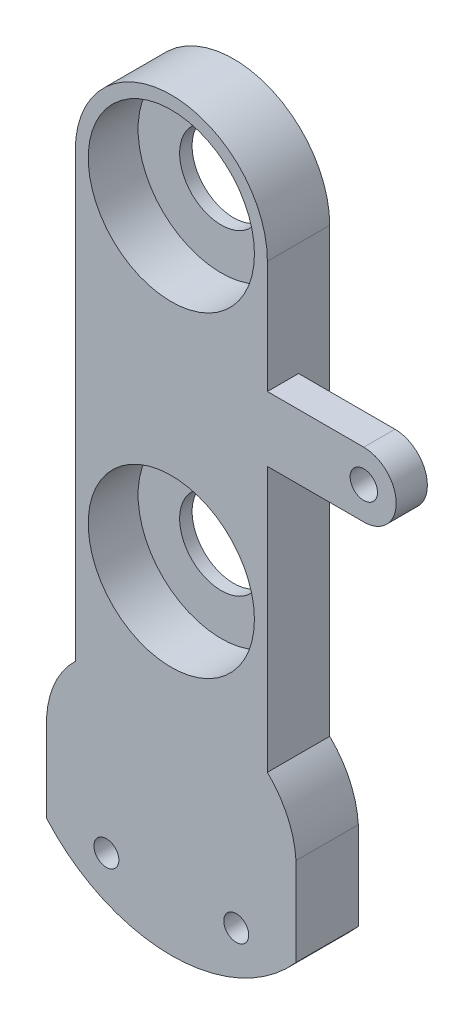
SolidWorks part; units mm, degrees
ref_plane "Front Plane" through (0, 0, 0) normal (0, 0, 1) x (1, 0, 0)
ref_plane "Top Plane" through (0, 0, 0) normal (0, 1, 0) x (1, 0, 0)
ref_plane "Right Plane" through (0, 0, 0) normal (1, 0, 0) x (0, 0, -1)
sketch "Sketch2" plane through (0, 0, 0) normal (0, 0, 1) x (1, 0, 0)
  line L2 (0, 0) -> (0, 21.2346)
  line L4 (60.0123, 0) -> (60.0123, 21.2346)
  line L9 (6.8855, 142.6991) -> (6.8855, 113.6827)
  line L10 (30.0061, 66.4505) -> (30.0061, -13.5495) construction
  line L11 (0, 10.6173) -> (60.0123, 10.6173) construction
  line L12 (14.3811, 0) -> (45.6311, 0) construction
  line L13 (53.1268, 115.5577) -> (53.1268, 142.6991)
  line L14 (30.0061, 165.8197) -> (30.0061, 142.6505) construction
  line L15 (30.0061, 66.4505) -> (30.0061, -13.5495) construction
  line L16 (6.8855, 113.6827) -> (6.8855, 36.191)
  line L18 (53.1268, 36.191) -> (53.1268, 99.9564)
  line L20 (76.3256, 99.9564) -> (53.1268, 99.9564)
  line L21 (76.3256, 115.5508) -> (53.1268, 115.5577)
  arc A0 (0, 0) -> (60.0123, 0) centre (30.0061, 26.4505) ccw
  circle A2 centre (30.0061, 142.6505) radius 20
  arc A3 (6.8855, 142.6991) -> (53.1268, 142.6991) centre (30.0061, 142.6991) cw
  circle A7 centre (14.3811, 0) radius 3
  circle A8 centre (45.6311, 0) radius 3
  circle A10 centre (30.0061, 66.4505) radius 20
  arc A11 (0, 21.2346) -> (6.8855, 36.191) centre (22.6023, 19.8923) cw
  arc A12 (60.0123, 21.2346) -> (53.1268, 36.191) centre (37.41, 19.8923) ccw
  arc A13 (76.3256, 99.9564) -> (76.3256, 115.5508) centre (76.3256, 107.7536) ccw
  dimension "D2" = 31.25
  dimension "D4" = 40
  dimension "D3" = 40
  dimension "D5" = 40
  dimension "D8" = 22.6421
  dimension "D10" = 6
  dimension "D11" = 6
  dimension "D12" = 23.1207
  dimension "D13" = 40
  dimension "D6" = 29.0164
  dimension "D7" = 77.4917
  dimension "D9" = 21.2346
  dimension "D14" = 179.3692
  dimension "D15" = 80
  dimension "D16" = 76.2
  dimension "D17" = 23.1692
  dimension "D18" = 46.2413
  dimension "D19" = 21.2346
  dimension "D20" = 60.0123
extrude "Boss-Extrude5" add sketch "Sketch2" along normal blind 15
sketch "Sketch3" plane through (0, 0, 15) normal (0, 0, 1) x (1, 0, 0)
  line L0 (30.0061, 142.6991) -> (30.0061, 66.4991) construction
  circle A0 centre (30.0061, 142.6991) radius 20
  circle A1 centre (30.0061, 66.4991) radius 20
  dimension "D1" = 76.2
extrude "Cut-Extrude1" cut sketch "Sketch3" against normal blind 12
sketch "Sketch4" plane through (0, 0, 15) normal (0, 0, 1) x (1, 0, 0)
  circle A0 centre (30.0061, 142.6991) radius 10
  circle A1 centre (30.0061, 66.4991) radius 10
extrude "Cut-Extrude2" cut sketch "Sketch4" against normal blind 15
sketch "Sketch6" plane through (0, 0, 15) normal (0, 0, 1) x (1, 0, 0)
  line L0 (76.3256, 115.5508) -> (53.1268, 115.5577)
  line L1 (53.1268, 115.5577) -> (53.1268, 99.9564)
  line L2 (53.1268, 99.9564) -> (76.3256, 99.9564)
  arc A0 (76.3256, 99.9564) -> (76.3256, 115.5508) centre (76.3256, 107.7536) ccw
extrude "Cut-Extrude3" cut sketch "Sketch6" along normal blind 7.5 from surface at -15
sketch "Sketch8" plane through (0, 0, 7.5) normal (0, 0, -1) x (-1, 0, 0)
  circle A0 centre (-76.3256, 107.7536) radius 3.3
  arc A1 (-76.3256, 115.5508) -> (-76.3256, 99.9564) centre (-76.3256, 107.7536) ccw construction
  point P2 (-77.008, 107.715)
  point P3 (0, 0)
  point P5 (0, 0)
  dimension "D1" = 6.6
extrude "Cut-Extrude4" cut sketch "Sketch8" against normal through all
